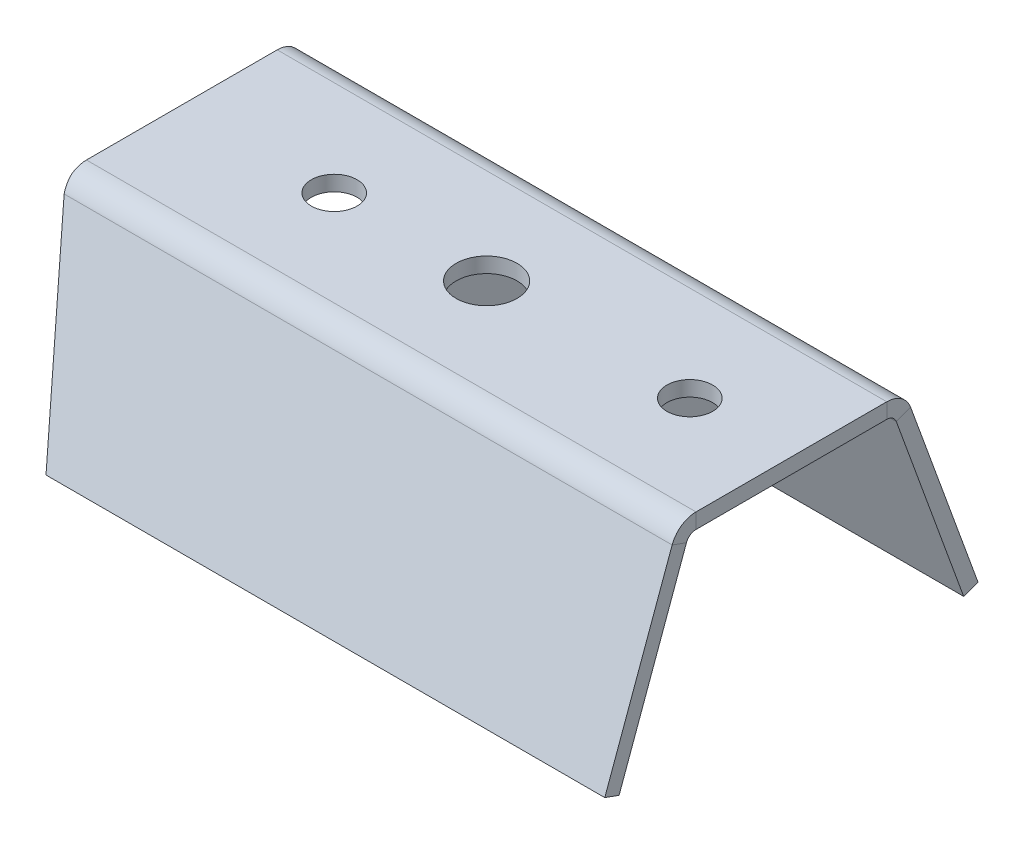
SolidWorks part; units mm, degrees
ref_plane "Front Plane" through (0, 0, 0) normal (0, 0, 1) x (1, 0, 0)
ref_plane "Top Plane" through (0, 0, 0) normal (0, 1, 0) x (1, 0, 0)
ref_plane "Right Plane" through (0, 0, 0) normal (1, 0, 0) x (0, 0, -1)
sketch "Sketch1" plane through (0, 0, 0) normal (0, 1, 0) x (1, 0, 0)
  line L0 (0, 0) -> (60, 0) construction
  line L1 (60, -30) -> (60, 30)
  line L2 (60, 30) -> (5, 30)
  line L3 (5, 30) -> (0, 10)
  line L4 (0, 10) -> (0, -10)
  line L5 (5, -30) -> (0, -10)
  line L6 (60, -30) -> (5, -30)
  circle A0 centre (50, 0) radius 2.25
  circle A1 centre (30, 0) radius 3
  circle A2 centre (15, 0) radius 2.25
  dimension "D1" = 4.5
  dimension "D2" = 10
  dimension "D3" = 6
  dimension "D4" = 20
  dimension "D5" = 15
  dimension "D6" = 4.5
  dimension "D10" = 15
  dimension "D7" = 10
  dimension "D8" = 30
  dimension "D9" = 55
sheet metal parameters "Sheet-Metal1" thickness 1.5 parameters "D1"=1
base flange "Base-Flange1" sketch "Sketch1" thickness 1.5 reverse thickness direction yes parameters "D1"=1
sketch "Sketch3" plane through (0, 1.5, 0) normal (0, 1, 0) x (1, 0, 0)
  line L0 (0, 10) -> (60, 10)
  line L1 (60, -30) -> (60, 30) construction
  line L2 (0, -10) -> (60, -10)
sketched bend "Sketched Bend1" parameters "D1"=0
bend "SketchBend1" bend radius 1 bend angle 70 parameters "D5"=1
bend "SketchBend2" bend radius 0 bend angle 70 parameters "D5"=2
flat pattern "Flat-Pattern1"
sketch "Bend-Lines1" plane through (0, 0, 0) normal (0, 1, 0) x (-1, 0, 0)
bend of the flat pattern "Flatten-<SketchBend1>1"
bend of the flat pattern "Flatten-<SketchBend2>1"
